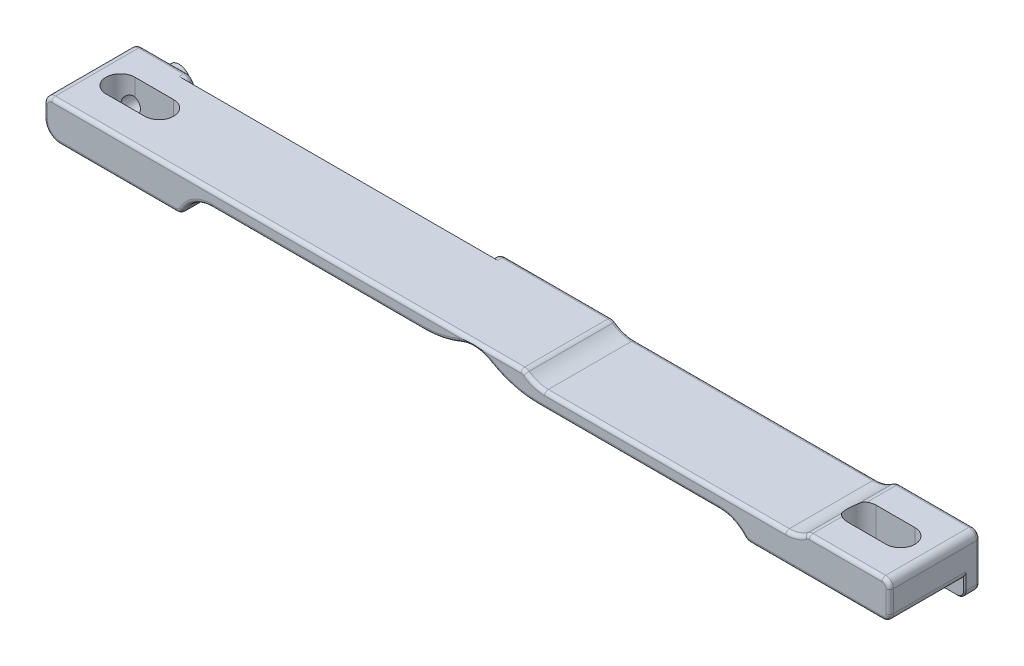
SolidWorks part; units mm, degrees
ref_plane "Front Plane" through (0, 0, 0) normal (0, 0, 1) x (1, 0, 0)
ref_plane "Top Plane" through (0, 0, 0) normal (0, 1, 0) x (1, 0, 0)
ref_plane "Right Plane" through (0, 0, 0) normal (1, 0, 0) x (0, 0, -1)
sketch "Sketch1" plane through (0, 0, 0) normal (0, 0, 1) x (1, 0, 0)
  line L1 (-12.065, 10.16) -> (184.9687, 10.16)
  line L2 (-15.24, 6.985) -> (-15.24, -5.715)
  line L3 (-5.715, -15.24) -> (334.01, -15.24)
  line L4 (337.185, 6.985) -> (337.185, -12.065)
  line L5 (194.703, 6.985) -> (294.247, 6.985)
  line L7 (303.9813, 10.16) -> (334.01, 10.16)
  arc A0 (-12.065, 10.16) -> (-15.24, 6.985) centre (-12.065, 6.985) ccw
  arc A1 (-15.24, -5.715) -> (-5.715, -15.24) centre (-5.715, -5.715) ccw
  arc A2 (334.01, -15.24) -> (337.185, -12.065) centre (334.01, -12.065) ccw
  arc A3 (334.01, 10.16) -> (337.185, 6.985) centre (334.01, 6.985) cw
  arc A4 (186.8407, 9.5494) -> (194.703, 6.985) centre (194.703, 20.32) ccw
  arc A5 (294.247, 6.985) -> (302.1093, 9.5494) centre (294.247, 20.32) ccw
  arc A6 (186.8407, 9.5494) -> (184.9687, 10.16) centre (184.9687, 6.985) ccw
  arc A7 (303.9813, 10.16) -> (302.1093, 9.5494) centre (303.9813, 6.985) ccw
  point P7 (-15.24, 10.16)
  point P10 (-15.24, -15.24)
  point P15 (337.185, 10.16)
  point P26 (-15.24, -15.24)
  dimension "D5" = 3.175
  dimension "D9" = 26.67
  dimension "D10" = 3.175
  dimension "D11" = 9.525
  dimension "D1" = 352.425
  dimension "D2" = 25.4
  dimension "D3" = 10.16
  dimension "D4" = 15.24
  dimension "D6" = 3.175
  dimension "D7" = 194.703
  dimension "D8" = 294.247
extrude "Main Body" add sketch "Sketch1" against normal blind 41.275
hole_wizard "1/4-20 Tapped Hole1" positions "Sketch5" profile "Sketch4" tap size "1/4-20" standard "Ansi Inch"
sketch "Sketch5" plane through (0, 0, -41.275) normal (0, 0, -1) x (-1, 0, 0)
  point P0 (0, 0)
sketch "Sketch4" plane through (0, 0, -41.275) normal (1, 0, 0) x (0, 1, 0)
  line L0 (0, 0) -> (0, 24.5999)
  line L1 (0, 24.5999) -> (2.8956, 22.86)
  line L2 (2.8956, 22.86) -> (2.8956, 19.05)
  line L3 (2.8956, 19.05) -> (3.175, 19.05)
  line L4 (3.175, 19.05) -> (3.175, 0)
  line L5 (3.175, 0) -> (0, 0)
  line L10 (0, 24.5999) -> (-2.8956, 22.86) construction
  line L11 (0, -6.35) -> (0, 107.95) construction
  dimension "Tap Drill Dia." = 5.7912
  dimension "Tap Drill Depth" = 22.86
  dimension "Thread Major Dia." = 6.35
  dimension "Thread Depth" = 19.05
  dimension "Drill Angle" = 118
hole_wizard "#10-32 Tapped Hole1" positions "Sketch8" profile "Sketch7" tap size "#10-32" standard "Ansi Inch"
sketch "Sketch8" plane through (0, 0, 0) normal (0, 0, 1) x (1, 0, 0)
  line L0 (0, 0) -> (186.4316, 0) construction
  point P0 (165.1, -1.27)
  dimension "D1" = 165.1
  dimension "D2" = 1.27
sketch "Sketch7" plane through (165.1, -1.27, 0) normal (1, 0, 0) x (0, -1, 0)
  line L0 (0, 0) -> (0, 41.275)
  line L1 (0, 41.275) -> (2.413, 41.275)
  line L2 (2.413, 41.275) -> (2.413, 0)
  line L5 (2.413, 0) -> (0, 0)
  line L11 (0, -6.35) -> (0, 107.95) construction
  dimension "Thread Major Dia." = 4.826
  dimension "Thru Tap Drill Depth" = 41.275
sketch "Sketch9" plane through (0, 0, -41.275) normal (0, 0, -1) x (-1, 0, 0)
  circle A0 centre (0, 0) radius 4.7625
  circle A1 centre (0, 0) radius 9.6266
  dimension "D1" = 19.2532
  dimension "D2" = 9.525
extrude "5906K533 Thrust Bearing Pocket" cut sketch "Sketch9" against normal blind 1.905
sketch "Sketch10" plane through (0, 0, -41.275) normal (0, 0, -1) x (-1, 0, 0)
  circle A0 centre (0, 0) radius 3.175 construction
  circle A1 centre (0, 0) radius 4.7625
  circle A2 centre (0, 0) radius 4.7625
  circle A3 centre (0, 0) radius 3.175
  dimension "D1" = 0
extrude ".255\" Tall R4 Bearing Boss" add sketch "Sketch10" along normal blind 6.477
sketch "Sketch11" plane through (0, 0, 0) normal (0, 0, 1) x (1, 0, 0)
  line L0 (-15.24, -5.08) -> (42.545, -5.08)
  line L2 (57.1914, 3.81) -> (145.8395, 3.81)
  line L4 (184.9687, 10.16) -> (-12.065, 10.16) construction
  line L6 (-15.24, 6.985) -> (-15.24, -5.715)
  line L7 (-5.715, -15.24) -> (334.01, -15.24)
  line L8 (337.185, -12.065) -> (337.185, 6.985)
  line L9 (334.01, 10.16) -> (303.9813, 10.16)
  line L10 (294.247, 6.985) -> (194.703, 6.985)
  line L11 (184.9687, 10.16) -> (-12.065, 10.16)
  line L12 (-15.24, -5.08) -> (-15.24, -5.715)
  line L13 (-5.715, -15.24) -> (334.01, -15.24)
  line L14 (337.185, -12.065) -> (337.185, -5.08)
  line L18 (182.6632, 0.635) -> (266.9081, 0.635)
  line L20 (279.4, -5.08) -> (337.185, -5.08)
  arc A0 (158.0962, -4.2718) -> (171.4866, -5.4264) centre (165.1, -1.27) ccw
  arc A1 (276.9977, -3.981) -> (266.9081, 0.635) centre (266.9081, -12.7) ccw
  arc A2 (182.6632, 0.635) -> (171.4866, -5.4264) centre (182.6632, -12.7) ccw
  arc A3 (158.0962, -4.2718) -> (145.8395, 3.81) centre (145.8395, -9.525) ccw
  arc A4 (279.4, -5.08) -> (276.9977, -3.981) centre (279.4, -1.905) cw
  arc A5 (57.1914, 3.81) -> (45.3616, -3.3704) centre (57.1914, -9.525) ccw
  arc A6 (42.545, -5.08) -> (45.3616, -3.3704) centre (42.545, -1.905) ccw
  circle A7 centre (165.1, -1.27) radius 2.413 construction
  arc A8 (-12.065, 10.16) -> (-15.24, 6.985) centre (-12.065, 6.985) ccw
  arc A10 (334.01, -15.24) -> (337.185, -12.065) centre (334.01, -12.065) ccw
  arc A11 (337.185, 6.985) -> (334.01, 10.16) centre (334.01, 6.985) ccw
  arc A12 (303.9813, 10.16) -> (302.1093, 9.5494) centre (303.9813, 6.985) ccw
  arc A13 (294.247, 6.985) -> (302.1093, 9.5494) centre (294.247, 20.32) ccw
  arc A14 (186.8407, 9.5494) -> (194.703, 6.985) centre (194.703, 20.32) ccw
  arc A15 (186.8407, 9.5494) -> (184.9687, 10.16) centre (184.9687, 6.985) ccw
  arc A18 (334.01, -15.24) -> (337.185, -12.065) centre (334.01, -12.065) ccw
  arc A24 (-15.24, -5.715) -> (-5.715, -15.24) centre (-5.715, -5.715) ccw
  arc A25 (-15.24, -5.715) -> (-5.715, -15.24) centre (-5.715, -5.715) ccw
  point P42 (45.72, -5.08)
  point P44 (276.225, -5.08)
  point P45 (276.225, -5.08)
  point P50 (45.72, -5.08)
  dimension "D2" = 15.24
  dimension "D6" = 13.335
  dimension "D11" = 3.175
  dimension "D12" = 10.16
  dimension "D9" = 26.67
  dimension "D10" = 3.175
  dimension "D3" = 10.16
  dimension "D4" = 10.16
  dimension "D5" = 6.35
  dimension "D7" = 45.72
  dimension "D8" = 60.96
  dimension "D13" = 42.545
  dimension "D1" = 0
extrude "Inside Relief cut" cut sketch "Sketch11" against normal blind 34.925
sketch "Sketch13" plane through (0, -5.08, 0) normal (0, -1, 0) x (1, 0, 0)
  line L0 (16.891, -22.606) -> (0.889, -22.606) construction
  line L1 (42.545, 0) -> (-15.24, 0) construction
  line L2 (-15.24, -34.925) -> (-15.24, 0) construction
  line L3 (16.891, -16.637) -> (0.889, -16.637)
  line L4 (16.891, -28.575) -> (0.889, -28.575)
  line L5 (322.961, -22.606) -> (306.959, -22.606) construction
  line L6 (337.185, 0) -> (279.4, 0) construction
  line L7 (322.961, -16.637) -> (306.959, -16.637)
  line L8 (322.961, -28.575) -> (306.959, -28.575)
  arc A0 (16.891, -16.637) -> (16.891, -28.575) centre (16.891, -22.606) cw
  arc A1 (0.889, -16.637) -> (0.889, -28.575) centre (0.889, -22.606) ccw
  arc A2 (322.961, -16.637) -> (322.961, -28.575) centre (322.961, -22.606) cw
  arc A3 (306.959, -16.637) -> (306.959, -28.575) centre (306.959, -22.606) ccw
  point P2 (8.89, -22.606)
  point P13 (314.96, -22.606)
  dimension "D1" = 16.002
  dimension "D2" = 22.606
  dimension "D3" = 24.13
  dimension "D6" = 16.002
  dimension "D7" = 22.606
  dimension "D8" = 330.2
  dimension "D4" = 5.969
  dimension "D5" = 5.969
  dimension "D9" = 5.969
  dimension "D10" = 5.969
extrude "(2) Thru slots " cut sketch "Sketch13" against normal up to next
sketch "Sketch15" plane through (0, 0, 0) normal (0, 0, 1) x (1, 0, 0)
  line L0 (165.1, -1.27) -> (165.1, 14.5589) construction
  circle A0 centre (165.1, -5.715) radius 13.6525
  dimension "D1" = 27.305
  dimension "D2" = 4.445
extrude "1.75\" dp rod end mount" cut sketch "Sketch15" against normal blind 29.845
fillet ".40\" Fillets" radius 38.1 2 edges at (177.6511, -0.3428, -14.9225) (153.4594, 1.4185, -14.9225)
fillet ".125\" Fillets on Ends" radius 3.175 2 edges at (337.185, -5.08, -17.4625) (-15.24, -5.08, -17.4625)
sketch "Sketch16" plane through (0, 0, -41.275) normal (0, 0, -1) x (-1, 0, 0)
  line L0 (-184.9687, 10.16) -> (12.065, 10.16) construction
  line L1 (-127, 10.16) -> (-181.4705, -15.24)
  line L3 (-181.4705, -15.24) -> (0, -15.24)
  line L4 (5.715, -15.24) -> (-334.01, -15.24) construction
  line L5 (-11.3592, 10.16) -> (-127, 10.16)
  arc A0 (-11.3592, 10.16) -> (0, -15.24) centre (0, 0) ccw
  dimension "D1" = 25
  dimension "D2" = 127
extrude ".130\" deep Arm clearance" cut sketch "Sketch16" against normal blind 3.302
fillet ".125\" Fillets" radius 3.175 2 edges at (181.4705, -15.24, -39.624) (127, 10.16, -39.624)
fillet ".060\" Fillets Arm clearance" [suppressed] radius 1.524
sketch "Sketch17" [suppressed] plane through (0, 0, -41.275) normal (0, 0, -1) x (-1, 0, 0)
  line L0 (-180.9761, -9.0033) -> (-178.4402, -8.8595)
  line L1 (-334.01, -13.716) -> (-182.1744, -13.716) construction
  line L2 (-323.243, 4.7642) -> (-311.178, -4.4814)
  line L3 (-313.2328, -10.541) -> (-329.1078, -10.541)
  line L4 (-332.486, -7.1628) -> (-332.486, 2.0828)
  line L5 (-329.1078, 5.461) -> (-325.2978, 5.461)
  line L6 (-141.3215, 6.096) -> (-184.6829, 6.096)
  line L7 (-194.703, 2.921) -> (-294.247, 2.921)
  line L8 (-304.2671, 6.096) -> (-334.01, 6.096)
  line L9 (-194.703, 5.461) -> (-294.247, 5.461) construction
  line L10 (-303.9813, 8.636) -> (-334.01, 8.636) construction
  line L11 (-305.2857, 6.096) -> (-309.7988, 6.096)
  line L12 (-335.661, 6.985) -> (-335.661, -12.065) construction
  line L13 (-311.8536, 0.0364) -> (-298.9599, -9.8442)
  line L14 (-141.3215, 8.636) -> (-184.9687, 8.636) construction
  line L15 (-277.8297, 2.921) -> (-252.4297, 2.921)
  line L16 (-293.1494, -9.6989) -> (-285.5294, -2.9933)
  line L17 (-250.3671, 2.2182) -> (-241.6696, -4.4874)
  line L18 (-243.7323, -10.541) -> (-280.4353, -10.541)
  line L20 (-238.227, -3.1326) -> (-229.5296, -9.8382)
  line L21 (-192.4654, -3.0084) -> (-182.8564, -8.5561)
  line L22 (-227.4669, -10.541) -> (-197.7409, -10.541)
  line L23 (-178.7006, 6.096) -> (-183.6643, 6.096)
  line L25 (-236.1643, 2.921) -> (-200.7006, 2.921)
  line L30 (-287.7611, 2.921) -> (-294.247, 2.921)
  line L31 (-296.9051, -10.541) -> (-295.3811, -10.541)
  arc A0 (-311.8536, 0.0364) -> (-309.7988, 6.096) centre (-309.7988, 2.7178) cw
  arc A1 (-303.4909, 5.5798) -> (-305.2857, 6.096) centre (-305.2857, 2.7178) ccw
  arc A2 (-285.5294, -2.9933) -> (-287.7611, 2.921) centre (-287.7611, -0.4572) ccw
  arc A3 (-293.1494, -9.6989) -> (-295.3811, -10.541) centre (-295.3811, -7.1628) cw
  arc A4 (-175.4589, 1.7673) -> (-175.4062, -4.4817) centre (-165.1, -1.27) ccw
  arc A5 (-298.9599, -9.8442) -> (-296.9051, -10.541) centre (-296.9051, -7.1628) ccw
  arc A6 (-282.9272, -4.8819) -> (-281.2079, -0.4572) centre (-287.7611, -0.4572) ccw
  arc A7 (-283.4319, -5.3768) -> (-287.7611, 6.096) centre (-287.7611, -0.4572) ccw construction
  arc A8 (-194.703, 2.921) -> (-184.6829, 6.096) centre (-194.703, 20.32) ccw
  arc A9 (-304.2671, 6.096) -> (-294.247, 2.921) centre (-294.247, 20.32) ccw
  arc A10 (-191.4147, 3.2346) -> (-185.4591, 5.5798) centre (-194.703, 20.32) ccw
  arc A11 (-303.4909, 5.5798) -> (-294.247, 2.921) centre (-294.247, 20.32) ccw
  arc A12 (-197.3248, -0.3298) -> (-195.3718, -4.7545) centre (-190.7763, -0.0828) ccw
  arc A13 (-192.0148, 6.3523) -> (-194.0529, -5.758) centre (-190.7763, -0.0828) ccw construction
  arc A14 (-277.8297, 2.921) -> (-281.2079, -0.4572) centre (-277.8297, -0.4572) ccw
  arc A15 (-241.6696, -4.4874) -> (-243.7323, -10.541) centre (-243.7323, -7.1628) cw
  arc A16 (-252.4297, 2.921) -> (-250.3671, 2.2182) centre (-252.4297, -0.4572) cw
  arc A17 (-238.227, -3.1326) -> (-236.1643, 2.921) centre (-236.1643, -0.4572) cw
  arc A18 (-180.9761, -9.0033) -> (-182.8564, -8.5561) centre (-181.1673, -5.6305) cw
  arc A19 (-178.4402, -8.8595) -> (-175.4062, -4.4817) centre (-178.6314, -5.4867) ccw
  arc A20 (-175.4589, 1.7673) -> (-178.7006, 6.096) centre (-178.7006, 2.7178) ccw
  arc A21 (-183.6643, 6.096) -> (-185.4591, 5.5798) centre (-183.6643, 2.7178) ccw
  arc A22 (-191.4147, 3.2346) -> (-192.4654, -3.0084) centre (-190.7763, -0.0828) ccw
  arc A23 (-229.5296, -9.8382) -> (-227.4669, -10.541) centre (-227.4669, -7.1628) ccw
  arc A24 (-197.3248, -0.3298) -> (-200.7006, 2.921) centre (-200.7006, -0.4572) ccw
  arc A25 (-282.9272, -4.8819) -> (-280.4353, -10.541) centre (-280.4353, -7.1628) ccw
  arc A26 (-197.7409, -10.541) -> (-195.3718, -4.7545) centre (-197.7409, -7.1628) ccw
  arc A27 (-311.178, -4.4814) -> (-313.2328, -10.541) centre (-313.2328, -7.1628) cw
  arc A28 (-323.243, 4.7642) -> (-325.2978, 5.461) centre (-325.2978, 2.0828) ccw
  arc A33 (-329.1078, -10.541) -> (-332.486, -7.1628) centre (-329.1078, -7.1628) cw
  arc A34 (-329.1078, 5.461) -> (-332.486, 2.0828) centre (-329.1078, 2.0828) ccw
  dimension "D4" = 21.59
  dimension "D3" = 3.3782
  dimension "D5" = 3.3782
  dimension "D13" = 3.3782
  dimension "D11" = 3.3782
  dimension "D16" = 3.175
  dimension "D19" = 3.3782
  dimension "D20" = 3.3782
  dimension "D21" = 25.4
  dimension "D22" = 36.703
  dimension "D2" = 3.175
  dimension "D6" = 3.175
  dimension "D7" = 3.175
  dimension "D8" = 3.175
  dimension "D12" = 7.112
  dimension "D23" = 3.81
  dimension "D24" = 15.875
  dimension "D25" = 1.524
  dimension "D26" = 7.62
  dimension "D37" = 30
  dimension "D38" = 2.54
  dimension "D9" = 2.54
  dimension "D10" = 6.7056
  dimension "D14" = 8.3483
  dimension "D17" = 2.54
  dimension "D18" = 3.175
  dimension "D1" = 2.54
  dimension "D15" = 3.175
extrude "Extrude1" [suppressed] cut sketch "Sketch17" against normal blind 4.445
sketch "Sketch19" [suppressed] plane through (0, 0, -37.973) normal (0, 0, -1) x (-1, 0, 0)
  line L0 (-150.5669, -6.0142) -> (-133.9146, 1.7509)
  line L1 (-133.9146, 1.7509) -> (-116.1175, 6.8541)
  line L2 (-112.5498, 5.7189) -> (-102.3898, -6.9638)
  line L3 (-105.0263, -12.4541) -> (-149.1392, -12.4541)
  line L4 (-105.0977, 1.4947) -> (-94.9377, -11.188)
  line L5 (-92.3012, -12.4541) -> (-82.7762, -12.4541)
  line L6 (-80.5391, -11.6072) -> (-66.1881, 1.0755)
  line L7 (-68.4252, 6.985) -> (-102.4612, 6.985)
  line L8 (-55.6649, 6.1381) -> (-70.0159, -6.5445)
  line L9 (-67.7788, -12.4541) -> (-42.3788, -12.4541)
  line L10 (-39.4449, -7.4013) -> (-46.6839, 5.2814)
  line L11 (-49.6178, 6.985) -> (-53.4278, 6.985)
  line L12 (-41.1164, 1.9322) -> (-33.8774, -10.7505)
  line L13 (-30.9435, -12.4541) -> (-19.8134, -12.4541)
  line L14 (-38.1825, 6.985) -> (-21.4927, 6.985)
  line L15 (-177.8644, -15.24) -> (-6.9838, -15.24) construction
  line L16 (-13.3344, 10.16) -> (-137.8574, 10.16) construction
  line L17 (-131.2658, 6.985) -> (-110.7569, 6.985) construction
  line L18 (-139.3356, 2.7263) -> (-177.8644, -15.24) construction
  arc A0 (-150.5669, -6.0142) -> (-149.1392, -12.4541) centre (-149.1392, -9.0759) ccw
  arc A1 (-116.1175, 6.8541) -> (-112.5498, 5.7189) centre (-115.1863, 3.6068) cw
  arc A2 (-13.7257, 12.2767) -> (0, -18.415) centre (0, 0) ccw
  arc A3 (-18.161, 3.0477) -> (-16.7421, -7.669) centre (0, 0) ccw
  arc A4 (-102.3898, -6.9638) -> (-105.0263, -12.4541) centre (-105.0263, -9.0759) cw
  arc A5 (-94.9377, -11.188) -> (-92.3012, -12.4541) centre (-92.3012, -9.0759) ccw
  arc A6 (-82.7762, -12.4541) -> (-80.5391, -11.6072) centre (-82.7762, -9.0759) ccw
  arc A7 (-105.0977, 1.4947) -> (-102.4612, 6.985) centre (-102.4612, 3.6068) cw
  arc A8 (-66.1881, 1.0755) -> (-68.4252, 6.985) centre (-68.4252, 3.6068) ccw
  arc A9 (-55.6649, 6.1381) -> (-53.4278, 6.985) centre (-53.4278, 3.6068) cw
  arc A10 (-46.6839, 5.2814) -> (-49.6178, 6.985) centre (-49.6178, 3.6068) ccw
  arc A11 (-70.0159, -6.5445) -> (-67.7788, -12.4541) centre (-67.7788, -9.0759) ccw
  arc A12 (-42.3788, -12.4541) -> (-39.4449, -7.4013) centre (-42.3788, -9.0759) ccw
  arc A13 (-33.8774, -10.7505) -> (-30.9435, -12.4541) centre (-30.9435, -9.0759) ccw
  arc A14 (-41.1164, 1.9322) -> (-38.1825, 6.985) centre (-38.1825, 3.6068) cw
  arc A15 (-21.4927, 6.985) -> (-18.161, 3.0477) centre (-21.4927, 3.6068) cw
  arc A16 (-19.8134, -12.4541) -> (-16.7421, -7.669) centre (-19.8134, -9.0759) ccw
  dimension "D2" = 3.3782
  dimension "D3" = 2.7859
  dimension "D4" = 3.175
  dimension "D5" = 3.175
  dimension "D6" = 16
  dimension "D7" = 33.9528
  dimension "D8" = 10.16
  dimension "D9" = 3.175
  dimension "D10" = 3.175
  dimension "D11" = 9.525
  dimension "D12" = 34.036
  dimension "D13" = 3.81
  dimension "D14" = 25.4
  dimension "D15" = 3.175
  dimension "D1" = 3.175
extrude "Extrude3" [suppressed] cut sketch "Sketch19" against normal blind 1.524
fillet "Fillet2" [suppressed] radius 0.762
sketch "Sketch20" plane through (0, -15.24, 0) normal (0, -1, 0) x (1, 0, 0)
  line L1 (-96.5399, 25.9231) -> (396.3738, 25.9231)
  line L2 (-96.5399, 25.9231) -> (-96.5399, -56.0494)
  line L3 (-96.5399, -56.0494) -> (396.3738, -56.0494)
  line L4 (396.3738, 25.9231) -> (396.3738, -56.0494)
extrude "Extrude4" cut sketch "Sketch20" against normal blind 3.175
sketch "Sketch21" plane through (0, 0, -41.275) normal (0, 0, -1) x (-1, 0, 0)
  line L0 (12.065, 10.16) -> (12.065, 0)
  line L1 (12.8145, -12.065) -> (-9.3109, -12.065) construction
  line L5 (-9.3109, -12.065) -> (12.8145, -12.065)
  line L6 (0, -12.065) -> (12.8145, -12.065)
  line L7 (15.24, -5.715) -> (15.24, 6.985)
  line L8 (15.24, -5.715) -> (15.24, 6.985)
  line L9 (12.065, 10.16) -> (-11.3592, 10.16)
  arc A0 (0, -12.065) -> (12.065, 0) centre (0, 0) ccw
  arc A4 (12.8145, -12.065) -> (15.24, -5.715) centre (5.715, -5.715) ccw
  arc A5 (12.8145, -12.065) -> (15.24, -5.715) centre (5.715, -5.715) ccw
  arc A6 (15.24, 6.985) -> (12.065, 10.16) centre (12.065, 6.985) ccw
  arc A7 (15.24, 6.985) -> (12.065, 10.16) centre (12.065, 6.985) ccw
  arc A8 (-11.3592, 10.16) -> (-9.3109, -12.065) centre (0, 0) ccw
  dimension "D1" = 0
extrude "Extrude5" cut sketch "Sketch21" against normal through all
fillet "Fillet3" radius 3.302 1 edges at (-12.065, 10.16, -20.6375)
sketch "Sketch22" plane through (0, 0, 0) normal (0, 0, 1) x (1, 0, 0)
  line L0 (-12.065, 6.858) -> (-12.065, 0) construction
  line L1 (-39.6345, 59.9714) -> (401.976, 59.9714)
  line L2 (-39.6345, 59.9714) -> (-39.6345, -56.8385)
  line L3 (-39.6345, -56.8385) -> (401.976, -56.8385)
  line L4 (401.976, 59.9714) -> (401.976, -56.8385)
  line L5 (184.9687, 10.16) -> (-8.763, 10.16) construction
  dimension "D1" = 414.041
  dimension "D2" = 27.5695
  dimension "D3" = 49.8114
  dimension "D4" = 66.9985
extrude "Extrude6" cut sketch "Sketch22" against normal offset from surface (3.937 mm away) 43.815
sketch "Sketch23" plane through (0, 0, -3.937) normal (0, 0, 1) x (1, 0, 0)
  line L9 (191.6051, 0.635) -> (266.9081, 0.635)
  line L10 (279.4, -5.08) -> (334.01, -5.08)
  line L11 (337.185, -1.905) -> (337.185, 6.985)
  line L12 (334.01, 10.16) -> (303.9813, 10.16)
  line L13 (294.247, 6.985) -> (194.703, 6.985)
  line L14 (184.9687, 10.16) -> (-8.763, 10.16)
  line L15 (-12.065, 6.858) -> (-12.065, 0)
  line L16 (-10.9434, -5.08) -> (42.545, -5.08)
  line L17 (57.1914, 3.81) -> (144.8471, 3.81)
  line L18 (-12.065, 1.524) -> (-12.065, 0)
  line L25 (-10.9434, -5.08) -> (-5.461, -5.08)
  arc A0 (-12.065, 1.524) -> (-5.461, -5.08) centre (-5.461, 1.524) ccw
  arc A15 (144.8471, 3.81) -> (159.7572, 6.8487) centre (144.8471, 41.91) ccw
  arc A16 (172.0921, 6.0111) -> (159.7572, 6.8487) centre (165.1, -5.715) ccw
  arc A17 (172.0921, 6.0111) -> (191.6051, 0.635) centre (191.6051, 38.735) ccw
  arc A18 (276.9977, -3.981) -> (266.9081, 0.635) centre (266.9081, -12.7) ccw
  arc A19 (276.9977, -3.981) -> (279.4, -5.08) centre (279.4, -1.905) ccw
  arc A20 (334.01, -5.08) -> (337.185, -1.905) centre (334.01, -1.905) ccw
  arc A21 (337.185, 6.985) -> (334.01, 10.16) centre (334.01, 6.985) ccw
  arc A22 (303.9813, 10.16) -> (302.1093, 9.5494) centre (303.9813, 6.985) ccw
  arc A23 (294.247, 6.985) -> (302.1093, 9.5494) centre (294.247, 20.32) ccw
  arc A24 (186.8407, 9.5494) -> (194.703, 6.985) centre (194.703, 20.32) ccw
  arc A25 (186.8407, 9.5494) -> (184.9687, 10.16) centre (184.9687, 6.985) ccw
  arc A26 (-8.763, 10.16) -> (-12.065, 6.858) centre (-8.763, 6.858) ccw
  arc A27 (-12.065, 0) -> (-10.9434, -5.08) centre (0, 0) ccw
  arc A28 (42.545, -5.08) -> (45.3616, -3.3704) centre (42.545, -1.905) ccw
  arc A29 (57.1914, 3.81) -> (45.3616, -3.3704) centre (57.1914, -9.525) ccw
  arc A31 (-12.065, 0) -> (-10.9434, -5.08) centre (0, 0) ccw
  dimension "D2" = 13.208
  dimension "D1" = 0
extrude "Extrude7" cut sketch "Sketch23" against normal up to surface (30.988 mm away)
fillet "Fillet4" radius 3.302 2 edges at (9.3109, -12.065, -39.624) (11.3592, 10.16, -39.624)
fillet "Fillet5" radius 3.302 1 edges at (337.185, -12.065, -38.1)
fillet "Fillet7" radius 3.302 1 edges at (174.6617, -12.065, -39.624)
fillet "Fillet6" radius 1.524 46 edges at (0.5043, 10.16, -41.275) (-11.0979, 9.1929, -41.275) (-12.065, 3.429, -41.275) (-8.5312, -8.5312, -41.275) (4.0536, -12.065, -41.275) (9.3113, -11.8376, -41.275) (15.1542, -1.6147, -41.275) (156.989, -3.8241, -41.275) (138.2218, 7.6722, -41.275) (163.1451, 10.16, -41.275) (185.9532, 10.0035, -41.275) (190.568, 7.6423, -41.275) (244.475, 6.985, -41.275) (298.382, 7.6423, -41.275) (302.9968, 10.0035, -41.275) (318.9957, 10.16, -41.275) (336.2551, 9.2301, -41.275) (337.185, -0.889, -41.275) (336.2179, -11.0979, -41.275) (336.2551, 9.2301, -3.937) (337.185, 2.54, -3.937) (336.2551, -4.1501, -3.937) (306.705, -5.08, -3.937) (278.0791, -4.7922, -3.937) (272.4558, -0.5738, -3.937) (229.2566, 0.635, -3.937) (181.4851, 2.0036, -3.937) (166.0249, 7.9061, -3.937) (152.4554, 4.5774, -3.937) (101.0192, 3.81, -3.937) (50.2722, 1.8744, -3.937) (44.1924, -4.6192, -3.937) (18.542, -5.08, -3.937) (-10.1307, -3.1457, -3.937) (-12.065, 4.191, -3.937) (-11.0979, 9.1929, -3.937) (88.1028, 10.16, -3.937) (185.9532, 10.0035, -3.937) (190.568, 7.6423, -3.937) (244.475, 6.985, -3.937) (298.382, 7.6423, -3.937) (302.9968, 10.0035, -3.937) (11.2947, 9.7877, -41.275) (254.6384, -12.065, -41.275) (318.9957, 10.16, -3.937) (174.679, -11.9867, -41.275)
sketch "Sketch25" plane through (0, 0, -41.275) normal (0, 0, -1) x (-1, 0, 0)
  line L2 (-333.883, -7.366) -> (-175.3937, -7.366)
  line L3 (-329.184, -7.366) -> (-317.1513, -7.366)
  line L4 (-301.0742, -7.366) -> (-291.7444, -7.366)
  line L5 (-231.611, -7.366) -> (-199.7915, -7.366)
  line L6 (-192.4654, -3.0084) -> (-185.6839, -6.9236)
  line L7 (-184.0329, -7.366) -> (-178.9173, -7.366)
  line L8 (-178.7006, 6.096) -> (-183.6643, 6.096)
  line L9 (-279.1232, -1.5851) -> (-274.938, 2.0979)
  line L10 (-276.9418, -7.366) -> (-247.6268, -7.366)
  line L11 (-288.4009, -9.7495) -> (-283.4319, -5.3768) construction
  line L12 (-200.7006, 2.921) -> (-236.1643, 2.921)
  line L13 (-238.227, -3.1326) -> (-233.6271, -6.679)
  line L14 (-290.4984, -7.366) -> (-285.5294, -2.9933) construction
  line L19 (-245.6106, -1.449) -> (-250.3671, 2.2182)
  line L20 (-252.4297, 2.921) -> (-272.7566, 2.921)
  line L28 (-311.8536, 0.0364) -> (-303.0826, -6.6849)
  line L30 (-289.563, -6.5429) -> (-285.5294, -2.9933)
  line L31 (-287.7611, 2.921) -> (-294.247, 2.921)
  line L32 (-305.2857, 6.096) -> (-309.7988, 6.096)
  line L36 (-315.1428, -1.4431) -> (-323.243, 4.7642)
  line L37 (-325.2978, 5.461) -> (-329.1078, 5.461)
  line L38 (-332.486, 2.0828) -> (-332.486, -4.064)
  circle A0 centre (-165.1, -1.27) radius 2.413 construction
  arc A1 (-332.486, -4.064) -> (-329.184, -7.366) centre (-329.184, -4.064) ccw
  arc A2 (-315.1428, -1.4431) -> (-317.1513, -7.366) centre (-317.1513, -4.064) cw
  arc A3 (-303.0826, -6.6849) -> (-301.0742, -7.366) centre (-301.0742, -4.064) ccw
  arc A4 (-289.563, -6.5429) -> (-291.7444, -7.366) centre (-291.7444, -4.064) cw
  arc A5 (-245.6106, -1.449) -> (-247.6268, -7.366) centre (-247.6268, -4.064) cw
  arc A6 (-233.6271, -6.679) -> (-231.611, -7.366) centre (-231.611, -4.064) ccw
  arc A7 (-185.6839, -6.9236) -> (-184.0329, -7.366) centre (-184.0329, -4.064) ccw
  arc A8 (-178.9173, -7.366) -> (-175.6808, -3.4095) centre (-178.9173, -4.064) ccw
  arc A9 (-199.7915, -7.366) -> (-196.7709, -2.7301) centre (-199.7915, -4.064) ccw
  arc A10 (-279.1232, -1.5851) -> (-276.9418, -7.366) centre (-276.9418, -4.064) ccw
  arc A11 (-274.938, 2.0979) -> (-272.7566, 2.921) centre (-272.7566, -0.381) cw
  arc A14 (-191.4147, 3.2346) -> (-192.4654, -3.0084) centre (-190.7763, -0.0828) ccw
  arc A17 (-175.4589, 1.7673) -> (-175.6808, -3.4095) centre (-165.1, -1.27) ccw
  arc A18 (-175.4589, 1.7673) -> (-178.7006, 6.096) centre (-178.7006, 2.7178) ccw
  arc A19 (-183.6643, 6.096) -> (-185.4591, 5.5798) centre (-183.6643, 2.7178) ccw
  arc A20 (-191.4147, 3.2346) -> (-185.4591, 5.5798) centre (-194.703, 20.32) ccw
  arc A25 (-197.3248, -0.3298) -> (-196.7709, -2.7301) centre (-190.7763, -0.0828) ccw
  arc A26 (-197.3248, -0.3298) -> (-200.7006, 2.921) centre (-200.7006, -0.4572) ccw
  arc A27 (-236.1643, 2.921) -> (-238.227, -3.1326) centre (-236.1643, -0.4572) ccw
  arc A38 (-250.3671, 2.2182) -> (-252.4297, 2.921) centre (-252.4297, -0.4572) ccw
  arc A46 (-309.7988, 6.096) -> (-311.8536, 0.0364) centre (-309.7988, 2.7178) ccw
  arc A49 (-285.5294, -2.9933) -> (-287.7611, 2.921) centre (-287.7611, -0.4572) ccw
  arc A50 (-303.4909, 5.5798) -> (-294.247, 2.921) centre (-294.247, 20.32) ccw
  arc A51 (-303.4909, 5.5798) -> (-305.2857, 6.096) centre (-305.2857, 2.7178) ccw
  arc A55 (-323.243, 4.7642) -> (-325.2978, 5.461) centre (-325.2978, 2.0828) ccw
  arc A56 (-329.1078, 5.461) -> (-332.486, 2.0828) centre (-329.1078, 2.0828) ccw
  point P37 (-285.6924, -7.366)
  point P60 (-302.1939, -7.366)
  point P70 (-290.4984, -7.366)
  point P77 (-232.7361, -7.366)
  point P81 (-184.9177, -7.366)
  dimension "D4" = 3.302
  dimension "D5" = 3.302
  dimension "D6" = 3.302
  dimension "D7" = 6.604
  dimension "D2" = 3.302
  dimension "D1" = 3.175
  dimension "D3" = 3.175
extrude "Extrude8" cut sketch "Sketch25" against normal blind 4.445 contours L37 A56 L38 A1 L3 A2 L36 A55 | A50 A51 L32 A46 L28 A3 L4 A4 L30 A49 L31 | L19 A38 L20 A11 L9 A10 L10 A5 | L12 A27 L13 A6 L5 A9 A25 A26 | A20 A14 L6 A7 L7 A8 A17 A18 L8 A19
chamfer "Chamfer1" [suppressed] distance 0.635 angle 45
sketch "Sketch26" [suppressed] plane through (0, 0, -37.973) normal (0, 0, -1) x (-1, 0, 0)
  line L0 (-95.7016, -8.255) -> (-77.9959, -8.255)
  line L1 (-63.2286, -8.255) -> (-44.6443, -8.255)
  line L2 (-173.2999, -8.255) -> (-10.054, -8.255)
  line L3 (-140.478, -8.255) -> (-108.2315, -8.255)
  line L4 (-33.3845, -8.255) -> (-21.1446, -8.255)
  line L9 (-105.6545, -2.8885) -> (-112.5498, 5.7189)
  line L10 (-116.1175, 6.8541) -> (-133.9146, 1.7509)
  line L11 (-133.9146, 1.7509) -> (-141.8734, -1.9604)
  line L17 (-75.8093, -7.4273) -> (-66.1881, 1.0755)
  line L18 (-68.4252, 6.985) -> (-102.4612, 6.985)
  line L19 (-105.0977, 1.4947) -> (-98.2787, -7.0175)
  line L25 (-41.7766, -3.3162) -> (-46.6839, 5.2814)
  line L26 (-49.6178, 6.985) -> (-53.4278, 6.985)
  line L27 (-55.6649, 6.1381) -> (-65.4153, -2.4787)
  line L31 (-21.4927, 6.985) -> (-38.1825, 6.985)
  line L32 (-41.1164, 1.9322) -> (-36.2522, -6.5898)
  arc A0 (-141.8734, -1.9604) -> (-140.478, -8.255) centre (-140.478, -4.953) ccw
  arc A1 (-105.6545, -2.8885) -> (-108.2315, -8.255) centre (-108.2315, -4.953) cw
  arc A2 (-98.2787, -7.0175) -> (-95.7016, -8.255) centre (-95.7016, -4.953) ccw
  arc A3 (-75.8093, -7.4273) -> (-77.9959, -8.255) centre (-77.9959, -4.953) cw
  arc A4 (-65.4153, -2.4787) -> (-63.2286, -8.255) centre (-63.2286, -4.953) ccw
  arc A5 (-41.7766, -3.3162) -> (-44.6443, -8.255) centre (-44.6443, -4.953) cw
  arc A6 (-36.2522, -6.5898) -> (-33.3845, -8.255) centre (-33.3845, -4.953) ccw
  arc A7 (-112.5498, 5.7189) -> (-116.1175, 6.8541) centre (-115.1863, 3.6068) ccw
  arc A8 (-17.9297, -4.1999) -> (-21.1446, -8.255) centre (-21.1446, -4.953) cw
  arc A16 (-66.1881, 1.0755) -> (-68.4252, 6.985) centre (-68.4252, 3.6068) ccw
  arc A17 (-102.4612, 6.985) -> (-105.0977, 1.4947) centre (-102.4612, 3.6068) ccw
  arc A23 (-46.6839, 5.2814) -> (-49.6178, 6.985) centre (-49.6178, 3.6068) ccw
  arc A24 (-53.4278, 6.985) -> (-55.6649, 6.1381) centre (-53.4278, 3.6068) ccw
  arc A34 (-18.161, 3.0477) -> (-17.9297, -4.1999) centre (0, 0) ccw
  arc A35 (-18.161, 3.0477) -> (-21.4927, 6.985) centre (-21.4927, 3.6068) ccw
  arc A36 (-38.1825, 6.985) -> (-41.1164, 1.9322) centre (-38.1825, 3.6068) ccw
  point P21 (-97.2873, -8.255)
  point P33 (-71.9513, -8.255)
  point P43 (-35.3018, -8.255)
  dimension "D2" = 3.302
  dimension "D1" = 3.175
extrude "Extrude9" [suppressed] cut sketch "Sketch26" against normal blind 1.524
chamfer "Chamfer2" [suppressed] distance 0.635 angle 45
sketch "Sketch27" plane through (0, 0, -3.937) normal (0, 0, 1) x (1, 0, 0)
  line L18 (194.703, 6.985) -> (294.247, 6.985) construction
  line L19 (-8.763, 10.16) -> (184.9687, 10.16) construction
  line L20 (-12.065, 1.524) -> (-12.065, 6.858) construction
  line L21 (42.545, -5.08) -> (-5.461, -5.08) construction
  line L22 (144.8471, 3.81) -> (57.1914, 3.81) construction
  line L23 (266.9081, 0.635) -> (191.6051, 0.635) construction
  line L24 (334.01, -5.08) -> (279.4, -5.08) construction
  line L25 (337.185, 6.985) -> (337.185, -1.905) construction
  line L26 (303.9813, 10.16) -> (334.01, 10.16) construction
  line L27 (194.703, 6.985) -> (294.247, 6.985)
  line L28 (-8.763, 10.16) -> (184.9687, 10.16)
  line L29 (-12.065, 1.524) -> (-12.065, 6.858)
  line L30 (42.545, -5.08) -> (-5.461, -5.08)
  line L31 (144.8471, 3.81) -> (57.1914, 3.81)
  line L32 (266.9081, 0.635) -> (191.6051, 0.635)
  line L33 (334.01, -5.08) -> (279.4, -5.08)
  line L34 (337.185, 6.985) -> (337.185, -1.905)
  line L35 (303.9813, 10.16) -> (334.01, 10.16)
  arc A30 (186.8407, 9.5494) -> (194.703, 6.985) centre (194.703, 20.32) ccw construction
  arc A31 (186.8407, 9.5494) -> (184.9687, 10.16) centre (184.9687, 6.985) ccw construction
  arc A32 (-8.763, 10.16) -> (-12.065, 6.858) centre (-8.763, 6.858) ccw construction
  arc A33 (-12.065, 1.524) -> (-5.461, -5.08) centre (-5.461, 1.524) ccw construction
  arc A34 (42.545, -5.08) -> (45.3616, -3.3704) centre (42.545, -1.905) ccw construction
  arc A35 (57.1914, 3.81) -> (45.3616, -3.3704) centre (57.1914, -9.525) ccw construction
  arc A36 (144.8471, 3.81) -> (159.7572, 6.8487) centre (144.8471, 41.91) ccw construction
  arc A37 (172.0921, 6.0111) -> (159.7572, 6.8487) centre (165.1, -5.715) ccw construction
  arc A38 (172.0921, 6.0111) -> (191.6051, 0.635) centre (191.6051, 38.735) ccw construction
  arc A39 (276.9977, -3.981) -> (266.9081, 0.635) centre (266.9081, -12.7) ccw construction
  arc A40 (276.9977, -3.981) -> (279.4, -5.08) centre (279.4, -1.905) ccw construction
  arc A41 (334.01, -5.08) -> (337.185, -1.905) centre (334.01, -1.905) ccw construction
  arc A42 (337.185, 6.985) -> (334.01, 10.16) centre (334.01, 6.985) ccw construction
  arc A43 (303.9813, 10.16) -> (302.1093, 9.5494) centre (303.9813, 6.985) ccw construction
  arc A44 (294.247, 6.985) -> (302.1093, 9.5494) centre (294.247, 20.32) ccw construction
  arc A45 (186.8407, 9.5494) -> (194.703, 6.985) centre (194.703, 20.32) ccw
  arc A46 (186.8407, 9.5494) -> (184.9687, 10.16) centre (184.9687, 6.985) ccw
  arc A47 (-8.763, 10.16) -> (-12.065, 6.858) centre (-8.763, 6.858) ccw
  arc A48 (-12.065, 1.524) -> (-5.461, -5.08) centre (-5.461, 1.524) ccw
  arc A49 (42.545, -5.08) -> (45.3616, -3.3704) centre (42.545, -1.905) ccw
  arc A50 (57.1914, 3.81) -> (45.3616, -3.3704) centre (57.1914, -9.525) ccw
  arc A51 (144.8471, 3.81) -> (159.7572, 6.8487) centre (144.8471, 41.91) ccw
  arc A52 (172.0921, 6.0111) -> (159.7572, 6.8487) centre (165.1, -5.715) ccw
  arc A53 (172.0921, 6.0111) -> (191.6051, 0.635) centre (191.6051, 38.735) ccw
  arc A54 (276.9977, -3.981) -> (266.9081, 0.635) centre (266.9081, -12.7) ccw
  arc A55 (276.9977, -3.981) -> (279.4, -5.08) centre (279.4, -1.905) ccw
  arc A56 (334.01, -5.08) -> (337.185, -1.905) centre (334.01, -1.905) ccw
  arc A57 (337.185, 6.985) -> (334.01, 10.16) centre (334.01, 6.985) ccw
  arc A58 (303.9813, 10.16) -> (302.1093, 9.5494) centre (303.9813, 6.985) ccw
  arc A59 (294.247, 6.985) -> (302.1093, 9.5494) centre (294.247, 20.32) ccw
sketch "Sketch28" plane through (0, 0, -3.937) normal (0, 0, 1) x (1, 0, 0)
  line L0 (145.8395, 3.81) -> (57.1914, 3.81) construction
  line L1 (266.9081, 0.635) -> (182.6632, 0.635) construction
  line L2 (334.01, -5.08) -> (279.4, -5.08) construction
  line L3 (42.545, -5.08) -> (-5.461, -5.08) construction
  line L4 (145.8395, 3.81) -> (57.1914, 3.81)
  line L5 (266.9081, 0.635) -> (182.6632, 0.635)
  line L6 (334.01, -5.08) -> (279.4, -5.08)
  line L7 (42.545, -5.08) -> (-5.461, -5.08)
  line L8 (337.185, 6.985) -> (337.185, -1.905) construction
  line L9 (303.9813, 10.16) -> (334.01, 10.16) construction
  line L10 (194.703, 6.985) -> (294.247, 6.985) construction
  line L11 (-8.763, 10.16) -> (184.9687, 10.16) construction
  line L12 (-12.065, 1.524) -> (-12.065, 6.858) construction
  line L13 (337.185, 6.985) -> (337.185, -1.905)
  line L14 (303.9813, 10.16) -> (334.01, 10.16)
  line L15 (194.703, 6.985) -> (294.247, 6.985)
  line L16 (-8.763, 10.16) -> (184.9687, 10.16)
  line L17 (-12.065, 1.524) -> (-12.065, 6.858)
  arc A0 (158.0962, -4.2718) -> (145.8395, 3.81) centre (145.8395, -9.525) ccw construction
  arc A1 (158.0962, -4.2718) -> (171.4866, -5.4264) centre (165.1, -1.27) ccw construction
  arc A2 (182.6632, 0.635) -> (171.4866, -5.4264) centre (182.6632, -12.7) ccw construction
  arc A3 (276.9977, -3.981) -> (266.9081, 0.635) centre (266.9081, -12.7) ccw construction
  arc A4 (276.9977, -3.981) -> (279.4, -5.08) centre (279.4, -1.905) ccw construction
  arc A5 (334.01, -5.08) -> (337.185, -1.905) centre (334.01, -1.905) ccw construction
  arc A6 (57.1914, 3.81) -> (45.3616, -3.3704) centre (57.1914, -9.525) ccw construction
  arc A7 (42.545, -5.08) -> (45.3616, -3.3704) centre (42.545, -1.905) ccw construction
  arc A8 (-12.065, 1.524) -> (-5.461, -5.08) centre (-5.461, 1.524) ccw construction
  arc A9 (158.0962, -4.2718) -> (145.8395, 3.81) centre (145.8395, -9.525) ccw
  arc A10 (158.0962, -4.2718) -> (171.4866, -5.4264) centre (165.1, -1.27) ccw
  arc A11 (182.6632, 0.635) -> (171.4866, -5.4264) centre (182.6632, -12.7) ccw
  arc A12 (276.9977, -3.981) -> (266.9081, 0.635) centre (266.9081, -12.7) ccw
  arc A13 (276.9977, -3.981) -> (279.4, -5.08) centre (279.4, -1.905) ccw
  arc A14 (334.01, -5.08) -> (337.185, -1.905) centre (334.01, -1.905) ccw
  arc A15 (57.1914, 3.81) -> (45.3616, -3.3704) centre (57.1914, -9.525) ccw
  arc A16 (42.545, -5.08) -> (45.3616, -3.3704) centre (42.545, -1.905) ccw
  arc A17 (-12.065, 1.524) -> (-5.461, -5.08) centre (-5.461, 1.524) ccw
  arc A18 (337.185, 6.985) -> (334.01, 10.16) centre (334.01, 6.985) ccw construction
  arc A19 (303.9813, 10.16) -> (302.1093, 9.5494) centre (303.9813, 6.985) ccw construction
  arc A20 (294.247, 6.985) -> (302.1093, 9.5494) centre (294.247, 20.32) ccw construction
  arc A21 (186.8407, 9.5494) -> (194.703, 6.985) centre (194.703, 20.32) ccw construction
  arc A22 (186.8407, 9.5494) -> (184.9687, 10.16) centre (184.9687, 6.985) ccw construction
  arc A23 (-8.763, 10.16) -> (-12.065, 6.858) centre (-8.763, 6.858) ccw construction
  arc A24 (337.185, 6.985) -> (334.01, 10.16) centre (334.01, 6.985) ccw
  arc A25 (303.9813, 10.16) -> (302.1093, 9.5494) centre (303.9813, 6.985) ccw
  arc A26 (294.247, 6.985) -> (302.1093, 9.5494) centre (294.247, 20.32) ccw
  arc A27 (186.8407, 9.5494) -> (194.703, 6.985) centre (194.703, 20.32) ccw
  arc A28 (186.8407, 9.5494) -> (184.9687, 10.16) centre (184.9687, 6.985) ccw
  arc A29 (-8.763, 10.16) -> (-12.065, 6.858) centre (-8.763, 6.858) ccw
sketch "Sketch29" plane through (0, 0, -3.937) normal (0, 0, 1) x (1, 0, 0)
  line L0 (0, -12.065) -> (333.883, -12.065) construction
  line L1 (337.185, -8.763) -> (337.185, -1.905) construction
  line L2 (-12.065, 0) -> (-12.065, 1.524) construction
  line L3 (0, -12.065) -> (333.883, -12.065)
  line L4 (337.185, -8.763) -> (337.185, -1.905)
  line L5 (-12.065, 0) -> (-12.065, 1.524)
  line L6 (-12.065, 1.524) -> (-12.065, 6.858) construction
  line L7 (-8.763, 10.16) -> (184.9687, 10.16) construction
  line L8 (194.703, 6.985) -> (294.247, 6.985) construction
  line L9 (303.9813, 10.16) -> (334.01, 10.16) construction
  line L10 (337.185, 6.985) -> (337.185, -1.905) construction
  line L11 (-12.065, 1.524) -> (-12.065, 6.858)
  line L12 (-8.763, 10.16) -> (184.9687, 10.16)
  line L13 (194.703, 6.985) -> (294.247, 6.985)
  line L14 (303.9813, 10.16) -> (334.01, 10.16)
  line L15 (337.185, 6.985) -> (337.185, -1.905)
  arc A0 (-12.065, 0) -> (0, -12.065) centre (0, 0) ccw construction
  arc A1 (333.883, -12.065) -> (337.185, -8.763) centre (333.883, -8.763) ccw construction
  arc A2 (-12.065, 0) -> (0, -12.065) centre (0, 0) ccw
  arc A3 (333.883, -12.065) -> (337.185, -8.763) centre (333.883, -8.763) ccw
  arc A4 (-8.763, 10.16) -> (-12.065, 6.858) centre (-8.763, 6.858) ccw construction
  arc A5 (186.8407, 9.5494) -> (184.9687, 10.16) centre (184.9687, 6.985) ccw construction
  arc A6 (186.8407, 9.5494) -> (194.703, 6.985) centre (194.703, 20.32) ccw construction
  arc A7 (294.247, 6.985) -> (302.1093, 9.5494) centre (294.247, 20.32) ccw construction
  arc A8 (303.9813, 10.16) -> (302.1093, 9.5494) centre (303.9813, 6.985) ccw construction
  arc A9 (337.185, 6.985) -> (334.01, 10.16) centre (334.01, 6.985) ccw construction
  arc A10 (-8.763, 10.16) -> (-12.065, 6.858) centre (-8.763, 6.858) ccw
  arc A11 (186.8407, 9.5494) -> (184.9687, 10.16) centre (184.9687, 6.985) ccw
  arc A12 (186.8407, 9.5494) -> (194.703, 6.985) centre (194.703, 20.32) ccw
  arc A13 (294.247, 6.985) -> (302.1093, 9.5494) centre (294.247, 20.32) ccw
  arc A14 (303.9813, 10.16) -> (302.1093, 9.5494) centre (303.9813, 6.985) ccw
  arc A15 (337.185, 6.985) -> (334.01, 10.16) centre (334.01, 6.985) ccw
ref_plane "Plane1" through (0, 0, -3.937) normal (0, 0, 1) x (1, 0, 0)
sketch "Sketch30" plane through (0, 0, -41.275) normal (0, 0, -1) x (-1, 0, 0)
  line L0 (0, -12.065) -> (-333.883, -12.065) construction
  line L1 (-337.185, -8.763) -> (-337.185, -1.905) construction
  line L2 (-337.185, 6.985) -> (-337.185, -1.905) construction
  line L3 (-303.9813, 10.16) -> (-334.01, 10.16) construction
  line L4 (-194.703, 6.985) -> (-294.247, 6.985) construction
  line L5 (8.763, 10.16) -> (-184.9687, 10.16) construction
  line L6 (12.065, 1.524) -> (12.065, 6.858) construction
  line L7 (12.065, 0) -> (12.065, 1.524) construction
  line L8 (0, -12.065) -> (-333.883, -12.065)
  line L9 (-337.185, -8.763) -> (-337.185, -1.905)
  line L10 (-337.185, 6.985) -> (-337.185, -1.905)
  line L11 (-303.9813, 10.16) -> (-334.01, 10.16)
  line L12 (-194.703, 6.985) -> (-294.247, 6.985)
  line L13 (8.763, 10.16) -> (-184.9687, 10.16)
  line L14 (12.065, 1.524) -> (12.065, 6.858)
  line L15 (12.065, 0) -> (12.065, 1.524)
  arc A0 (-337.185, -8.763) -> (-333.883, -12.065) centre (-333.883, -8.763) ccw construction
  arc A1 (-334.01, 10.16) -> (-337.185, 6.985) centre (-334.01, 6.985) ccw construction
  arc A2 (-302.1093, 9.5494) -> (-303.9813, 10.16) centre (-303.9813, 6.985) ccw construction
  arc A3 (-302.1093, 9.5494) -> (-294.247, 6.985) centre (-294.247, 20.32) ccw construction
  arc A4 (-194.703, 6.985) -> (-186.8407, 9.5494) centre (-194.703, 20.32) ccw construction
  arc A5 (-184.9687, 10.16) -> (-186.8407, 9.5494) centre (-184.9687, 6.985) ccw construction
  arc A6 (12.065, 6.858) -> (8.763, 10.16) centre (8.763, 6.858) ccw construction
  arc A7 (0, -12.065) -> (12.065, 0) centre (0, 0) ccw construction
  arc A8 (-337.185, -8.763) -> (-333.883, -12.065) centre (-333.883, -8.763) ccw
  arc A9 (-334.01, 10.16) -> (-337.185, 6.985) centre (-334.01, 6.985) ccw
  arc A10 (-302.1093, 9.5494) -> (-303.9813, 10.16) centre (-303.9813, 6.985) ccw
  arc A11 (-302.1093, 9.5494) -> (-294.247, 6.985) centre (-294.247, 20.32) ccw
  arc A12 (-194.703, 6.985) -> (-186.8407, 9.5494) centre (-194.703, 20.32) ccw
  arc A13 (-184.9687, 10.16) -> (-186.8407, 9.5494) centre (-184.9687, 6.985) ccw
  arc A14 (12.065, 6.858) -> (8.763, 10.16) centre (8.763, 6.858) ccw
  arc A15 (0, -12.065) -> (12.065, 0) centre (0, 0) ccw
sketch "Sketch31" plane through (0, 0, -41.275) normal (0, 0, -1) x (-1, 0, 0)
  line L0 (-337.185, -0.889) -> (-30.48, 0)
  line L1 (-337.185, -8.763) -> (-337.185, 6.985) construction
  line L2 (-30.4797, 0.127) -> (-28.8062, 0.127) construction
  arc A0 (-30.48, 0) -> (-30.4797, 0.127) centre (0, 0) ccw
  circle A1 centre (-9.3108, 29.0231) radius 25.4 construction
  dimension "D1" = 60.96
  dimension "D3" = 50.8
  dimension "D2" = 0.127
ref_plane "Plane2" through (0, 0, -14.097) normal (0, 0, 1) x (1, 0, 0)
sketch "Sketch32" plane through (0, 0, -3.937) normal (0, 0, 1) x (1, 0, 0)
  line L0 (303.9813, 10.16) -> (337.185, 10.16) construction
  line L1 (334.01, 10.16) -> (303.9813, 10.16) construction
  line L2 (337.185, -0.889) -> (337.185, 10.16) construction
  line L3 (337.185, -8.763) -> (337.185, 6.985) construction
  line L4 (303.9813, 8.636) -> (303.9813, 10.16) construction
  arc A0 (303.9813, 10.16) -> (302.1093, 9.5494) centre (303.9813, 6.985) ccw construction
sketch "Sketch34" plane through (0, -5.08, 0) normal (0, -1, 0) x (1, 0, 0)
  line L0 (337.185, -20.193) -> (337.185, -41.275) construction
  line L1 (337.185, -5.461) -> (337.185, -34.925) construction
  line L2 (309.4058, -41.275) -> (337.185, -41.275) construction
  line L3 (333.883, -41.275) -> (175.3937, -41.275) construction
sketch "Sketch35" plane through (0, 0, -41.275) normal (0, 0, -1) x (-1, 0, 0)
  line L0 (-318.9957, 10.16) -> (-337.185, 10.16) construction
  line L1 (-334.01, 10.16) -> (-303.9813, 10.16) construction
  line L2 (-337.185, -0.889) -> (-337.185, 10.16) construction
  line L3 (-337.185, -8.763) -> (-337.185, 6.985) construction
sketch "Sketch36" plane through (0, 0, -3.937) normal (0, 0, 1) x (1, 0, 0)
  line L0 (-15.24, 1.6766) -> (-12.065, 1.6766) construction
  line L1 (-15.24, 11.8032) -> (340.36, 11.8032)
  line L2 (-15.24, 11.8032) -> (-15.24, -13.5968)
  line L3 (-15.24, -13.5968) -> (340.36, -13.5968)
  line L4 (340.36, 11.8032) -> (340.36, -13.5968)
  line L5 (-12.065, 1.524) -> (-12.065, 6.858) construction
  line L6 (337.185, 1.6766) -> (340.36, 1.6766) construction
  line L7 (337.185, 6.985) -> (337.185, -1.905) construction
  line L8 (-15.24, 11.8032) -> (-370.84, 11.8032) construction
  dimension "D1" = 355.6
  dimension "D2" = 25.4
sketch "Sketch37" plane through (0, 0, -41.275) normal (0, 0, -1) x (-1, 0, 0)
  line L0 (-337.185, -8.763) -> (-337.185, 6.985) construction
  line L1 (-337.185, -8.763) -> (-337.185, 6.985)
chamfer "Chamfer3" distance 0.508 angle 45 64 edges at (215.7012, -7.366, -36.83) (197.0249, -5.8666, -36.83) (232.676, -7.1895, -36.83) (197.1617, -1.5562, -36.83) (235.9271, -4.9058, -36.83) (198.3573, 1.9762, -36.83) (239.362, 0.6324, -36.83) (218.4325, 2.921, -36.83) (215.7012, -7.366, -41.275) (197.0249, -5.8666, -41.275) (232.676, -7.1895, -41.275) (197.1617, -1.5562, -41.275) (235.9271, -4.9058, -41.275) (198.3573, 1.9762, -41.275) (239.362, 0.6324, -41.275) (218.4325, 2.921, -41.275) (-12.065, 0.762, -34.925) (337.185, -5.334, -34.925) (-8.5312, -8.5312, -34.925) (336.2179, -11.0979, -34.925) (166.9415, -12.065, -34.925) (145.3433, 3.81, -29.845) (153.1802, 1.6077, -29.845) (164.4454, -8.8618, -29.845) (187.1342, 0.635, -29.845) (176.306, -0.9779, -29.845) (167.513, -1.27, -41.275) (184.8876, -7.2535, -41.275) (181.4751, -7.366, -41.275) (189.0746, -4.966, -41.275) (176.3615, -6.1547, -41.275) (194.1076, 0.4779, -41.275) (175.8851, -0.8076, -41.275) (188.3281, 4.1309, -41.275) (175.9966, 4.7428, -41.275) (184.598, 5.9644, -41.275) (181.1824, 6.096, -41.275) (262.2843, -7.366, -41.275) (244.5012, -5.129, -41.275) (280.0312, -5.2298, -41.275) (247.9888, 0.3846, -41.275) (277.0306, 0.2564, -41.275) (251.3402, 2.7405, -41.275) (273.9224, 2.7084, -41.275) (262.5932, 2.921, -41.275) (287.5462, -4.7681, -41.275) (290.5787, -7.1534, -41.275) (284.6005, 0.7355, -41.275) (296.4093, -7.366, -41.275) (291.0041, 2.921, -41.275) (302.1346, -7.1911, -41.275) (299.0563, 3.5989, -41.275) (307.4681, -3.3243, -41.275) (304.352, 5.9644, -41.275) (312.998, 3.8027, -41.275) (307.5423, 6.096, -41.275) (323.1676, -7.366, -41.275) (314.0242, -5.1244, -41.275) (331.5189, -6.3989, -41.275) (319.1929, 1.6606, -41.275) (332.486, -0.9906, -41.275) (324.2129, 5.2821, -41.275) (331.4965, 4.4715, -41.275) (327.2028, 5.461, -41.275)
chamfer "Chamfer4" distance 0.508 angle 45 8 edges at (314.96, -5.08, -16.637) (300.99, -5.08, -22.606) (328.93, -5.08, -22.606) (314.96, -5.08, -28.575) (8.89, -5.08, -16.637) (-5.08, -5.08, -22.606) (22.86, -5.08, -22.606) (8.89, -5.08, -28.575)
